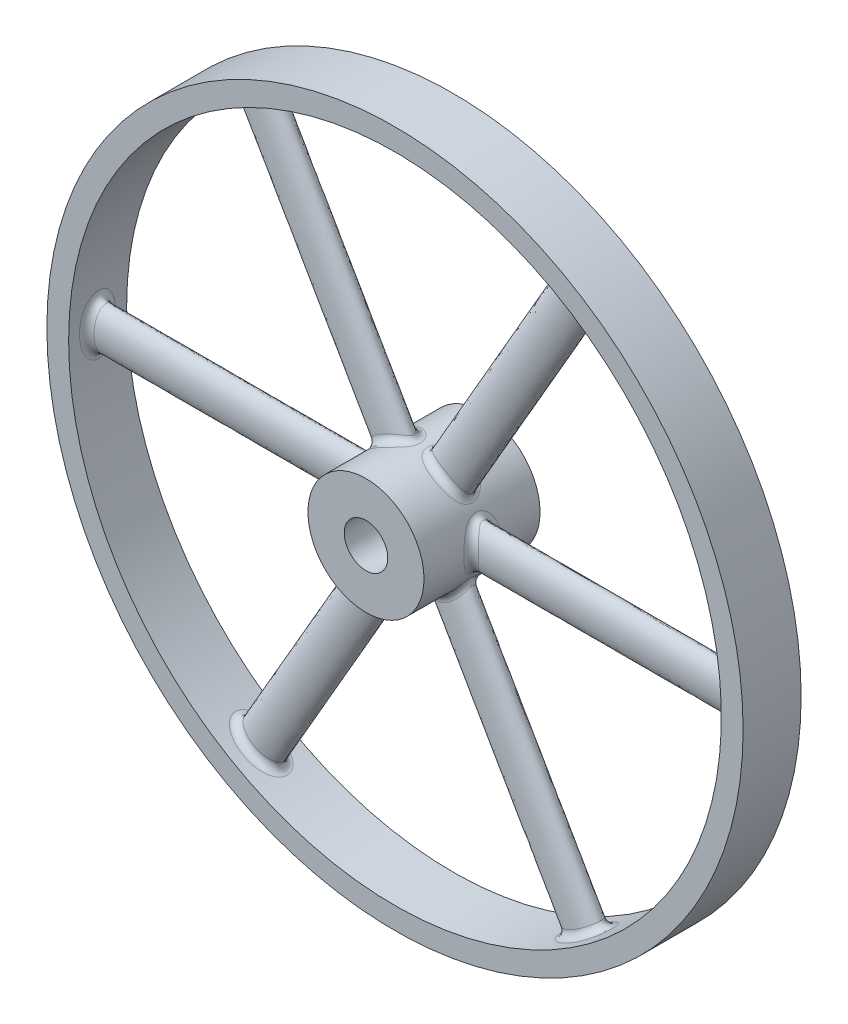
SolidWorks part; units mm, degrees
ref_plane "Front" through (0, 0, 0) normal (0, 0, 1) x (1, 0, 0)
ref_plane "Top" through (0, 0, 0) normal (0, 1, 0) x (1, 0, 0)
ref_plane "Right" through (0, 0, 0) normal (1, 0, 0) x (0, 0, -1)
sketch "Sketch3" plane through (0, 0, 0) normal (0, 1, 0) x (1, 0, 0)
  line L1 (152.4, 12.7) -> (142.875, 12.7)
  line L2 (152.4, 12.7) -> (152.4, -12.7)
  line L3 (152.4, -12.7) -> (142.875, -12.7)
  line L4 (142.875, 12.7) -> (142.875, -12.7)
  line L5 (0, 0) -> (152.4, 0) construction
  line L6 (0, 15.4927) -> (0, -15.4927) construction
  dimension "D1" = 25.4
  dimension "D2" = 9.525
  dimension "D3" = 304.8
revolve "Rim" add sketch "Sketch3" angle 360 about L6
sketch "Sketch5" plane through (0, 0, 0) normal (1, 0, 0) x (0, 0, -1)
  ellipse E0 centre (0, 0) end of major axis (0, 9.525) minor radius 4.7625
  dimension "D1" = 19.05
  dimension "D2" = 9.525
extrude "Spoke" add sketch "Sketch5" along normal up to next
sketch "Sketch6" plane through (0, 0, 0) normal (0, 0, 1) x (1, 0, 0)
  circle A0 centre (0, 0) radius 25.4
  dimension "D1" = 50.8
extrude "Hub" add sketch "Sketch6" along normal mid plane 50.8
fillet "Fillet1" radius 3.175 2 edges at (23.547, -9.5236, -0.0807) (142.5627, -9.4418, 0.6281)
pattern_circular "CirPattern1" count 6 over 360 of "Spoke", "Fillet1"
sketch "Sketch8" plane through (0, 0, 25.4) normal (0, 0, 1) x (1, 0, 0)
  circle A0 centre (0, 0) radius 9.525
  dimension "D1" = 19.05
extrude "Cut-Extrude1" cut sketch "Sketch8" against normal through all
